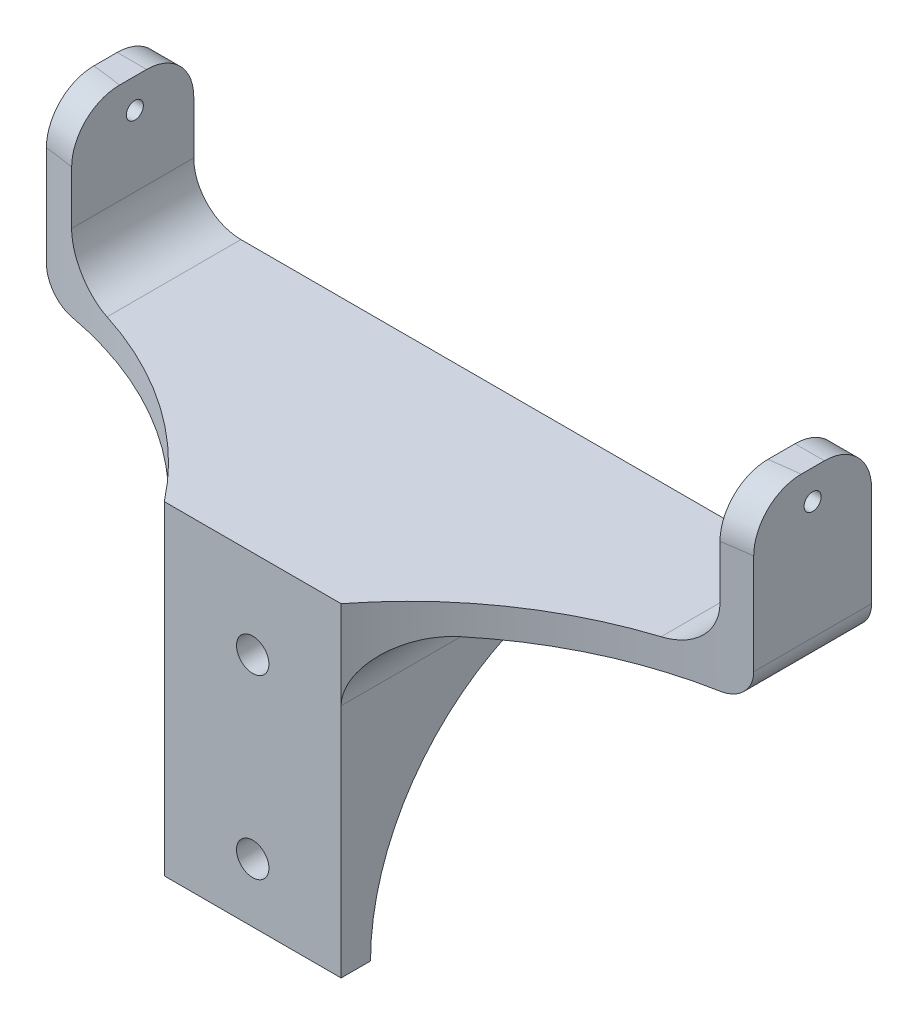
SolidWorks part; units mm, degrees
ref_plane "Front Plane" through (0, 0, 0) normal (0, 0, 1) x (1, 0, 0)
ref_plane "Top Plane" through (0, 0, 0) normal (0, 1, 0) x (1, 0, 0)
ref_plane "Right Plane" through (0, 0, 0) normal (1, 0, 0) x (0, 0, -1)
sketch "Sketch1" plane through (0, 0, 0) normal (0, 1, 0) x (1, 0, 0)
  line L3 (-56.5, 16.4933) -> (53.5, 16.4933)
  line L5 (-20.7825, -23.5342) -> (53.5, 16.4933) construction
  line L6 (-56.5, 16.4933) -> (17.1019, -24.2598) construction
  line L9 (-16.5, -28.5067) -> (13.5, -28.5067)
  line L13 (-1.5, -28.5067) -> (-1.5, 16.4933) construction
  line L14 (-56.5, 16.4933) -> (-61.5, 16.4933)
  line L17 (-61.5, 16.4933) -> (-61.5, -3.5067)
  line L18 (53.5, 16.4933) -> (58.5, 16.4933)
  line L19 (58.5, 16.4933) -> (58.5, -3.5067)
  arc A0 (-61.5, -3.5067) -> (-16.5, -28.5067) centre (-68.3442, -68.8262) cw
  arc A1 (58.5, -3.5067) -> (13.5, -28.5067) centre (65.3442, -68.8262) ccw
  point P0 (-2.2471, -13.5463)
  point P4 (0, 0)
  point P5 (0, -43.5067)
  dimension "D1" = 30
  dimension "D2" = 120
  dimension "D6" = 20
extrude "Boss-Extrude1" add sketch "Sketch1" along normal blind 30
sketch "Sketch2" plane through (0, 0, -16.4933) normal (0, 0, -1) x (-1, 0, 0)
  line L1 (-58.5, 0) -> (61.5, 0)
  line L2 (-58.5, 0) -> (-58.5, 30)
  line L3 (-58.5, 30) -> (61.5, 30)
  line L4 (61.5, 0) -> (61.5, 30)
  line L5 (-53.5, 30) -> (56.5, 30)
  line L6 (-53.5, 30) -> (-53.5, 5)
  line L7 (-53.5, 5) -> (56.5, 5)
  line L8 (56.5, 30) -> (56.5, 5)
  dimension "D1" = 5
  dimension "D2" = 5
  dimension "D3" = 25
extrude "Cut-Extrude1" cut sketch "Sketch2" against normal through all contours L7 L8 L5 L6
fillet "Fillet1" radius 8 2 edges at (-56.5, 5, -6.1337) (53.5, 5, -6.1337)
fillet "Fillet2" radius 8 4 edges at (-58.9931, 30, 3.8182) (-59, 30, -16.4933) (55.9931, 30, 3.8182) (56, 30, -16.4933)
sketch "Sketch3" plane through (-61.5, 0, 0) normal (-1, 0, 0) x (0, 0, 1)
  line L0 (-8.4933, 30) -> (-4.5323, 30) construction
  line L1 (-16.4933, 22) -> (-16.4933, 0) construction
  circle A0 centre (-6.4933, 25) radius 1.45
  dimension "D2" = 2.9
  dimension "D1" = 5
  dimension "D3" = 10
extrude "Cut-Extrude2" cut sketch "Sketch3" against normal through all
sketch "Sketch4" plane through (0, 0, 0) normal (0, -1, 0) x (-1, 0, 0)
  line L0 (-58.5, 16.4933) -> (61.5, 16.4933) construction
  line L1 (16.5, -28.5067) -> (-13.5, -28.5067)
  line L2 (16.5, -28.5067) -> (16.5, 16.4933)
  line L3 (16.5, 16.4933) -> (-13.5, 16.4933)
  line L4 (-13.5, -28.5067) -> (-13.5, 16.4933)
  dimension "D1" = 30
extrude "Boss-Extrude2" add sketch "Sketch4" along normal blind 50
sketch "Sketch5" plane through (-16.5, 0, 0) normal (-1, 0, 0) x (0, 0, 1)
  line L0 (-16.4933, -50) -> (23.5177, -50)
  line L1 (-16.4933, -50) -> (-16.4933, -9.9891)
  arc A0 (23.5177, -50) -> (-16.4933, -9.9891) centre (-16.4933, -50) ccw
extrude "Cut-Extrude3" cut sketch "Sketch5" against normal through all
sketch "Sketch6" plane through (0, -50, 0) normal (0, -1, 0) x (-1, 0, 0)
  line L0 (-13.5, 16.4933) -> (16.5, 16.4933) construction
  line L1 (11.5, 16.4933) -> (-8.5, 16.4933)
  line L2 (11.5, 16.4933) -> (11.5, -23.5177)
  line L3 (11.5, -23.5177) -> (-8.5, -23.5177)
  line L4 (-8.5, 16.4933) -> (-8.5, -23.5177)
  line L5 (-13.5, -23.5177) -> (16.5, -23.5177) construction
  line L6 (16.5, -28.5067) -> (16.5, -23.5177) construction
  line L7 (-13.5, 16.4933) -> (-13.5, -28.5067) construction
  dimension "D1" = 5
  dimension "D2" = 5
extrude "Cut-Extrude4" cut sketch "Sketch6" against normal blind 50
sketch "Sketch7" plane through (0, 0, 23.5177) normal (0, 0, -1) x (-1, 0, 0)
  line L0 (-8.5, -50) -> (11.5, -50) construction
  line L1 (11.5, 0) -> (-8.5, 0) construction
  line L2 (-13.5, -9.9891) -> (-13.5, -50) construction
  circle A0 centre (1.5, -40) radius 2.75
  circle A1 centre (1.5, -10) radius 2.75
  dimension "D1" = 5.5
  dimension "D2" = 5.5
  dimension "D3" = 10
  dimension "D4" = 10
  dimension "D5" = 15
  dimension "D6" = 15
extrude "Cut-Extrude5" cut sketch "Sketch7" against normal through all
fillet "Fillet3" radius 5 1 edges at (58.5, 0, -6.4933)
fillet "Fillet4" radius 5 1 edges at (-61.5, 0, -6.4933)
fillet "Fillet5" radius 10 2 edges at (-16.5, 0, 6.0067) (13.5, 0, 6.0067)
fillet "Fillet6" radius 2 2 edges at (-14, -9.9891, -16.4933) (11, -9.9891, -16.4933)
